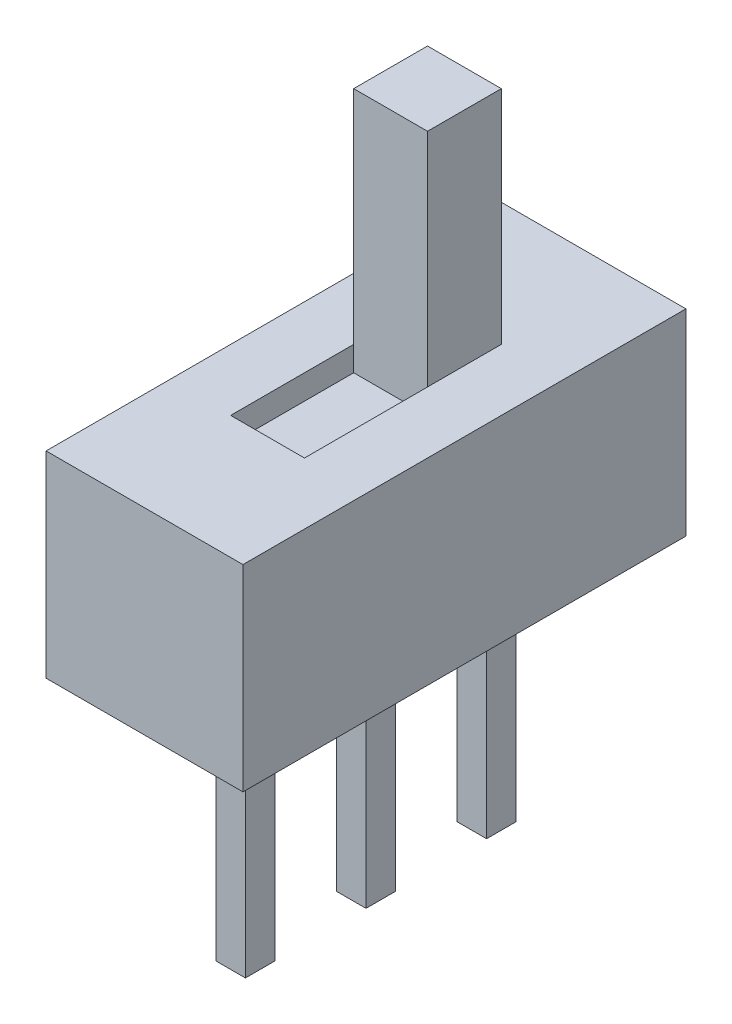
SolidWorks part; units mm, degrees
ref_plane "Спереди" through (0, 0, 0) normal (0, 0, 1) x (1, 0, 0)
ref_plane "Сверху" through (0, 0, 0) normal (0, 1, 0) x (1, 0, 0)
ref_plane "Справа" through (0, 0, 0) normal (1, 0, 0) x (0, 0, -1)
sketch "Эскиз1" plane through (0, 0, 0) normal (0, 0, 1) x (1, 0, 0)
  line L1 (0, 0) -> (4, 0)
  line L2 (0, 0) -> (0, 4)
  line L3 (0, 4) -> (4, 4)
  line L4 (4, 0) -> (4, 4)
  dimension "D1" = 4
extrude "Бобышка-Вытянуть1" add sketch "Эскиз1" along normal blind 9
sketch "Эскиз2" plane through (0, 4, 0) normal (0, 1, 0) x (1, 0, 0)
  line L0 (4, -4.5) -> (0, -4.5) construction
  line L1 (4, -9) -> (4, 0) construction
  line L2 (0, -9) -> (0, 0) construction
  line L3 (2, 0) -> (2, -9) construction
  line L4 (4, 0) -> (0, 0) construction
  line L5 (4, -9) -> (0, -9) construction
  line L7 (1.25, -2.5) -> (2.75, -2.5)
  line L8 (1.25, -2.5) -> (1.25, -4)
  line L9 (1.25, -4) -> (2.75, -4)
  line L10 (2.75, -2.5) -> (2.75, -4)
  dimension "D1" = 1.5
  dimension "D2" = 2.5
extrude "Бобышка-Вытянуть2" add sketch "Эскиз2" along normal blind 4.5
sketch "Эскиз3" plane through (0, 4, 0) normal (0, 1, 0) x (1, 0, 0)
  line L0 (0, -4.5) -> (4, -4.5) construction
  line L1 (0, -9) -> (0, 0) construction
  line L2 (4, -9) -> (4, 0) construction
  line L3 (2.75, -4) -> (2.75, -2.5) construction
  line L4 (1.25, -4) -> (2.75, -4)
  line L5 (1.25, -4) -> (1.25, -6.5)
  line L6 (1.25, -6.5) -> (2.75, -6.5)
  line L7 (2.75, -4) -> (2.75, -6.5)
  line L8 (4, -9) -> (0, -9) construction
  dimension "D1" = 2.5
extrude "Вырез-Вытянуть1" cut sketch "Эскиз3" against normal blind 0.5
sketch "Эскиз4" plane through (0, 0, 0) normal (0, -1, 0) x (1, 0, 0)
  line L0 (2, 9) -> (2, 0) construction
  line L1 (0, 9) -> (4, 9) construction
  line L2 (0, 0) -> (4, 0) construction
  line L3 (0, 4.5) -> (4, 4.5) construction
  line L4 (0, 9) -> (0, 0) construction
  line L5 (4, 9) -> (4, 0) construction
  line L6 (2.3, 1.75) -> (2.3, 2.35)
  line L7 (1.7, 7.25) -> (2.3, 7.25)
  line L8 (1.7, 7.25) -> (1.7, 6.65)
  line L9 (1.7, 6.65) -> (2.3, 6.65)
  line L10 (2.3, 7.25) -> (2.3, 6.65)
  line L11 (1.7, 2.35) -> (2.3, 2.35)
  line L12 (1.7, 1.75) -> (1.7, 2.35)
  line L13 (1.7, 1.75) -> (2.3, 1.75)
  line L15 (1.7, 4.8) -> (2.3, 4.8)
  line L16 (1.7, 4.8) -> (1.7, 4.2)
  line L17 (1.7, 4.2) -> (2.3, 4.2)
  line L18 (2.3, 4.8) -> (2.3, 4.2)
  dimension "D1" = 0.6
  dimension "D2" = 5.5
extrude "Бобышка-Вытянуть3" add sketch "Эскиз4" along normal blind 5
